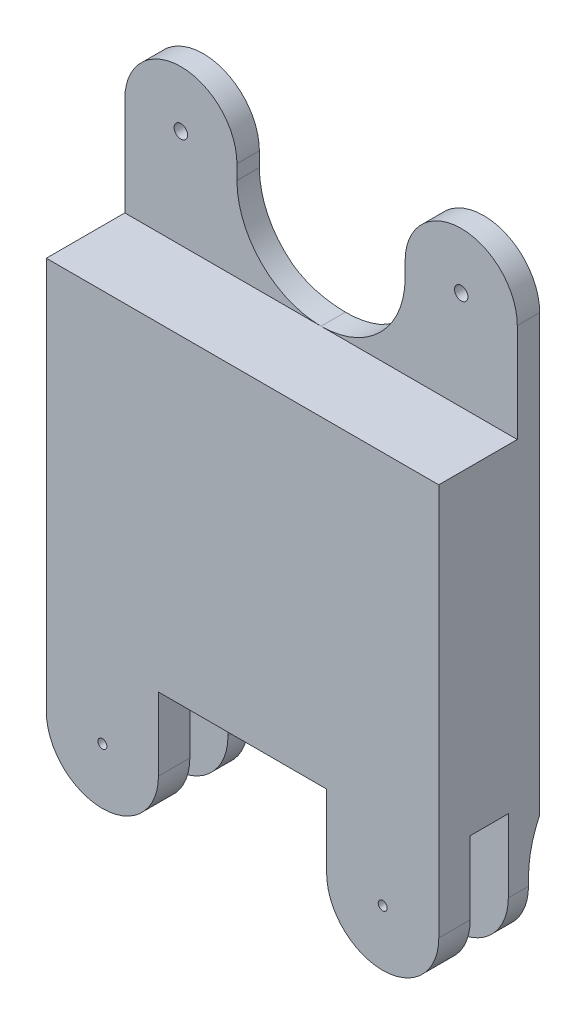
SolidWorks part; units mm, degrees
ref_plane "Front Plane" through (0, 0, 0) normal (0, 0, 1) x (1, 0, 0)
ref_plane "Top Plane" through (0, 0, 0) normal (0, 1, 0) x (1, 0, 0)
ref_plane "Right Plane" through (0, 0, 0) normal (1, 0, 0) x (0, 0, -1)
sketch "Sketch1" plane through (0, 0, 0) normal (0, 0, 1) x (1, 0, 0)
  line L0 (0, 37.6) -> (0, 50.1) construction
  line L2 (-17.5, 45.1) -> (-17.5, 50.1)
  line L3 (-17.5, 50.1) -> (-7.5, 50.1)
  line L4 (-7.5, 50.1) -> (-7.5, 45.1)
  line L8 (17.5, 50.1) -> (7.5, 50.1)
  line L9 (17.5, 45.1) -> (17.5, 50.1)
  line L10 (7.5, 50.1) -> (7.5, 45.1)
  arc A0 (-17.5, 45.1) -> (-7.5, 45.1) centre (-12.5, 45.1) ccw
  circle A1 centre (-12.5, 45.1) radius 0.4 construction
  arc A2 (-7.5, 45.1) -> (-17.5, 45.1) centre (-12.5, 45.1) ccw construction
  circle A4 centre (-12.5, 45.1) radius 0.4
  arc A7 (-7.5, 45.1) -> (7.5, 45.1) centre (0, 45.1) ccw construction
  circle A8 centre (12.5, 45.1) radius 0.4
  arc A9 (17.5, 45.1) -> (7.5, 45.1) centre (12.5, 45.1) cw
  dimension "D1" = 0.8
extrude "Boss-Extrude4" add sketch "Sketch1" along normal blind 3
ref_plane "Plane2" through (0, 0, -1.5) normal (0, 0, 1) x (1, 0, 0)
mirror "Mirror4" about plane through (0, 0, -1.5) normal (0, 0, 1)
sketch "Sketch3" plane through (0, 50.1, 0) normal (0, 1, 0) x (1, 0, 0)
  line L1 (17.5, -3) -> (-17.5, -3)
  line L2 (17.5, -3) -> (17.5, 6)
  line L3 (17.5, 6) -> (-17.5, 6)
  line L4 (-17.5, -3) -> (-17.5, 6)
extrude "Boss-Extrude5" add sketch "Sketch3" along normal blind 30
sketch "Sketch7" plane through (0, 0, -6) normal (0, 0, -1) x (-1, 0, 0)
  line L0 (-7.5, 50.1) -> (-7.5, 45.1) construction
  line L1 (-17.5, 80.1) -> (-17.5, 45.1) construction
  line L3 (17.5, 80.1) -> (17.5, 45.1) construction
  line L4 (7.5, 45.1) -> (7.5, 50.1) construction
  line L5 (-7.5, 50.1) -> (-7.5, 45.1)
  line L6 (-17.5, 50.1) -> (-17.5, 45.1)
  line L8 (17.5, 50.1) -> (17.5, 45.1)
  line L9 (7.5, 45.1) -> (7.5, 50.1)
  line L10 (-7.5, 50.1) -> (-17.5, 50.1)
  line L11 (7.5, 50.1) -> (17.5, 50.1)
  arc A0 (7.5, 45.1) -> (17.5, 45.1) centre (12.5, 45.1) ccw construction
  arc A1 (-17.5, 45.1) -> (-7.5, 45.1) centre (-12.5, 45.1) ccw construction
  arc A2 (7.5, 45.1) -> (17.5, 45.1) centre (12.5, 45.1) ccw
  arc A3 (-17.5, 45.1) -> (-7.5, 45.1) centre (-12.5, 45.1) ccw
extrude "Cut-Extrude1" cut sketch "Sketch7" against normal blind 1
sketch "Sketch8" plane through (0, 0, -5) normal (0, 0, -1) x (-1, 0, 0)
  line L0 (17.5, 45.1) -> (17.5, 42.604) construction
  line L1 (7.5, 45.1) -> (7.5, 41.74) construction
  line L2 (17.1837, 43.35) -> (7.8163, 43.35)
  arc A0 (7.5, 45.1) -> (17.5, 45.1) centre (12.5, 45.1) ccw construction
  arc A1 (7.8163, 43.35) -> (17.1837, 43.35) centre (12.5, 45.1) ccw
  dimension "D1" = 1.75
ref_plane "Plane3" through (17.5, 0, 0) normal (1, 0, 0) x (0, 0, -1)
sketch "Sketch13" plane through (17.5, 0, 0) normal (1, 0, 0) x (0, 0, -1)
  line L0 (5, 50.1) -> (5, 45.1) construction
  line L2 (3, 45.1) -> (3, 40.1)
  line L3 (3, 40.1) -> (5, 40.1)
  line L4 (5, 45.1) -> (5, 40.1)
  line L5 (3, 40.1) -> (5, 40.1) construction
  line L6 (3, 45.1) -> (5, 45.1)
fillet "Fillet1" radius 10 2 edges at (12.5, 50.1, -5) (-12.5, 50.1, -5)
sketch "Sketch23" plane through (0, 0, 0) normal (0, 0, -1) x (-1, 0, 0)
  line L9 (17.5, 45.1) -> (17.5, 50.1)
  line L10 (17.5, 50.1) -> (7.5, 50.1)
  line L11 (7.5, 50.1) -> (7.5, 45.1)
  line L15 (17.5, 45.1) -> (17.5, 50.1)
  line L16 (17.5, 50.1) -> (7.5, 50.1)
  line L17 (7.5, 50.1) -> (7.5, 45.1)
  line L18 (-17.5, 50.1) -> (-17.5, 45.1)
  line L22 (-7.5, 45.1) -> (-7.5, 50.1)
  line L23 (-7.5, 50.1) -> (-17.5, 50.1)
  line L24 (-17.5, 50.1) -> (-17.5, 45.1)
  line L28 (-7.5, 45.1) -> (-7.5, 50.1)
  line L29 (-7.5, 50.1) -> (-17.5, 50.1)
  arc A3 (7.5, 45.1) -> (17.5, 45.1) centre (12.5, 45.1) ccw
  arc A6 (7.5, 45.1) -> (17.5, 45.1) centre (12.5, 45.1) ccw
  arc A11 (-17.5, 45.1) -> (-7.5, 45.1) centre (-12.5, 45.1) ccw
  arc A14 (-17.5, 45.1) -> (-7.5, 45.1) centre (-12.5, 45.1) ccw
  dimension "D1" = 0
  dimension "D2" = 0
extrude "Cut-Extrude3" cut sketch "Sketch23" against normal blind 0.2
sketch "Sketch24" plane through (0, 0, -3) normal (0, 0, 1) x (1, 0, 0)
  line L3 (17.5, 45.1) -> (17.5, 50.1)
  line L4 (17.5, 50.1) -> (7.5, 50.1)
  line L5 (7.5, 50.1) -> (7.5, 45.1)
  line L6 (17.5, 45.1) -> (17.5, 50.1)
  line L7 (17.5, 50.1) -> (7.5, 50.1)
  line L8 (7.5, 50.1) -> (7.5, 45.1)
  line L9 (-7.5, 45.1) -> (-7.5, 50.1)
  line L10 (-7.5, 50.1) -> (-17.5, 50.1)
  line L11 (-17.5, 50.1) -> (-17.5, 45.1)
  line L12 (-7.5, 45.1) -> (-7.5, 50.1)
  line L13 (-7.5, 50.1) -> (-17.5, 50.1)
  line L14 (-17.5, 50.1) -> (-17.5, 45.1)
  arc A1 (7.5, 45.1) -> (17.5, 45.1) centre (12.5, 45.1) ccw
  arc A2 (7.5, 45.1) -> (17.5, 45.1) centre (12.5, 45.1) ccw
  arc A3 (-17.5, 45.1) -> (-7.5, 45.1) centre (-12.5, 45.1) ccw
  arc A4 (-17.5, 45.1) -> (-7.5, 45.1) centre (-12.5, 45.1) ccw
  dimension "D1" = 0
  dimension "D2" = 0
extrude "Cut-Extrude4" cut sketch "Sketch24" against normal blind 0.2
sketch "Sketch25" plane through (0, 50.1, 0) normal (0, -1, 0) x (1, 0, 0)
  line L12 (-7.5, 0.2) -> (-17.5, 0.2)
  line L13 (-17.5, 0.2) -> (-17.5, -3.2)
  line L14 (-17.5, -3.2) -> (-7.5, -3.2)
  line L15 (-7.5, -3.2) -> (-7.5, -6)
  line L16 (-7.5, -6) -> (7.5, -6)
  line L17 (7.5, -6) -> (7.5, -3.2)
  line L18 (7.5, -3.2) -> (17.5, -3.2)
  line L19 (17.5, -3.2) -> (17.5, 0.2)
  line L20 (17.5, 0.2) -> (7.5, 0.2)
  line L21 (7.5, 0.2) -> (7.5, 3)
  line L22 (7.5, 3) -> (-7.5, 3)
  line L23 (-7.5, 3) -> (-7.5, 0.2)
  line L24 (-7.5, 0.2) -> (-17.5, 0.2)
  line L25 (-17.5, 0.2) -> (-17.5, -3.2)
  line L26 (-17.5, -3.2) -> (-7.5, -3.2)
  line L27 (-7.5, -3.2) -> (-7.5, -6)
  line L28 (-7.5, -6) -> (7.5, -6)
  line L29 (7.5, -6) -> (7.5, -3.2)
  line L30 (7.5, -3.2) -> (17.5, -3.2)
  line L31 (17.5, -3.2) -> (17.5, 0.2)
  line L32 (17.5, 0.2) -> (7.5, 0.2)
  line L33 (7.5, 0.2) -> (7.5, 3)
  line L34 (7.5, 3) -> (-7.5, 3)
  line L35 (-7.5, 3) -> (-7.5, 0.2)
  dimension "D1" = 0
extrude "Cut-Extrude5" cut sketch "Sketch25" against normal blind 1.5
sketch "Sketch26" plane through (0, 0, -6) normal (0, 0, -1) x (-1, 0, 0)
  line L0 (0, 80.1) -> (0, 94.3497) construction
  line L1 (17.5, 80.1) -> (7.5, 80.1)
  line L2 (17.5, 80.1) -> (17.5, 88.9)
  line L4 (7.5, 80.1) -> (7.5, 88.9)
  line L5 (-17.5, 80.1) -> (17.5, 80.1) construction
  line L6 (-17.5, 80.1) -> (-17.5, 88.9)
  line L7 (-17.5, 80.1) -> (-7.5, 80.1)
  line L8 (-7.5, 80.1) -> (-7.5, 88.9)
  arc A0 (17.5, 88.9) -> (7.5, 88.9) centre (12.5, 88.9) ccw
  arc A1 (-17.5, 88.9) -> (-7.5, 88.9) centre (-12.5, 88.9) cw
  circle A2 centre (12.5, 88.9) radius 0.6
  circle A3 centre (-12.5, 88.9) radius 0.6
  dimension "D3" = 10
  dimension "D4" = 1.2
  dimension "D5" = 1.2
  dimension "D1" = 10
  dimension "D2" = 8.8
extrude "Boss-Extrude14" add sketch "Sketch26" against normal blind 2
fillet "Fillet9" radius 7.5 2 edges at (-7.5, 80.1, -5) (7.5, 80.1, -5)
sketch "Sketch21" plane through (0, 0, -6) normal (0, 0, -1) x (-1, 0, 0)
  line L5 (7.5, 51.6) -> (-7.5, 51.6) construction
  line L7 (-6.25, 76.6) -> (6.25, 76.6)
  line L8 (-6.25, 76.6) -> (-6.25, 51.6)
  line L9 (-6.25, 51.6) -> (6.25, 51.6)
  line L10 (6.25, 76.6) -> (6.25, 51.6)
  point P4 (0, 51.6)
  point P9 (0, 51.6)
  dimension "D1" = 12.5
  dimension "D2" = 25
extrude "Boss-Extrude13" add sketch "Sketch21" along normal blind 2
fillet "Fillet8" radius 7.5 3 edges at (-6.25, 64.1, -6) (6.25, 64.1, -6) (0, 76.6, -6)
